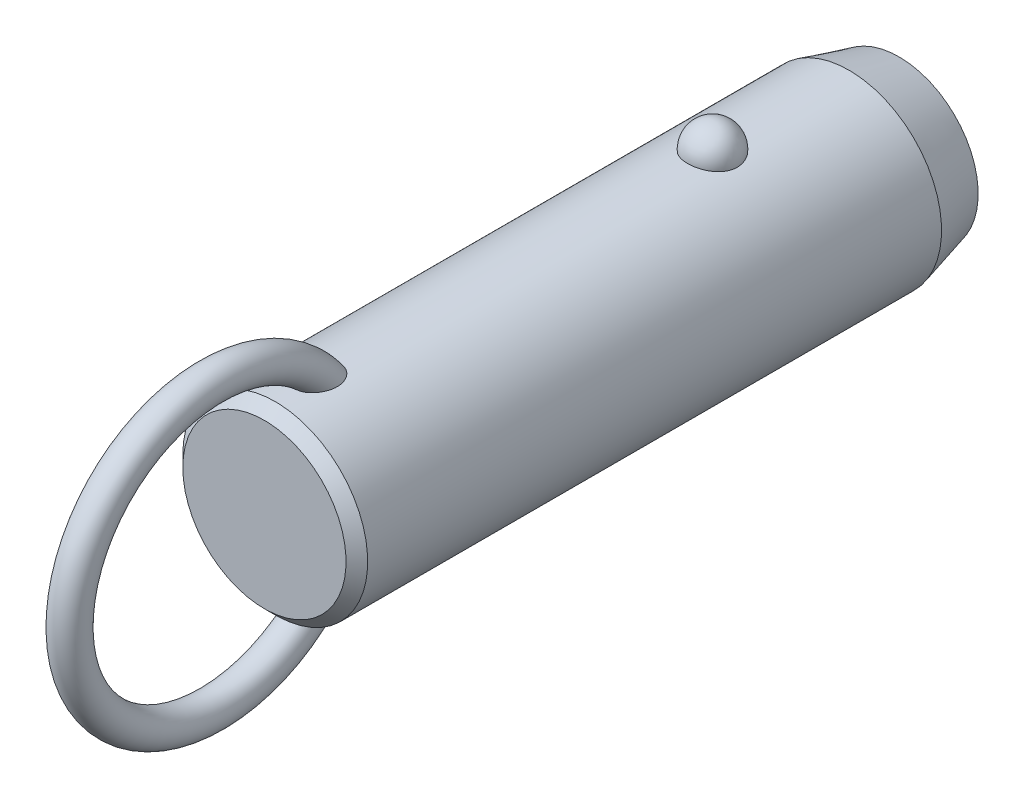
SolidWorks part; units mm, degrees
ref_plane "Front Plane" through (0, 0, 0) normal (0, 0, 1) x (1, 0, 0)
ref_plane "Top Plane" through (0, 0, 0) normal (0, 1, 0) x (1, 0, 0)
ref_plane "Right Plane" through (0, 0, 0) normal (1, 0, 0) x (0, 0, -1)
sketch "Sketch2" plane through (0, 0, 0) normal (0, 0, 1) x (1, 0, 0)
  circle A0 centre (0, 0) radius 11.1
  point P3 (0, 11.1)
  dimension "D1" = 22.2
extrude "Boss-Extrude1" add sketch "Sketch2" along normal blind 38.1
sketch "Sketch3" plane through (0, 0, 0) normal (0, 0, -1) x (-1, 0, 0)
  circle A0 centre (0, 0) radius 11.1
  dimension "D1" = 22.2
extrude "Boss-Extrude2" add sketch "Sketch3" along normal blind 25.4
chamfer "Chamfer1" distance 6 angle 15 1 edges at (-11.1, 0, -25.4)
sketch "Sketch12" plane through (0, 0, 0) normal (1, 0, 0) x (0, 0, -1)
  line L0 (-38.1, 11.1) -> (-38.1, -11.1) construction
  point P0 (-38.1, 0)
sketch "Sketch13" plane through (0, 0, 0) normal (1, 0, 0) x (0, 0, -1)
  circle A0 centre (-57.15, 0) radius 19.05
  point P2 (-38.1, 0)
  dimension "D1" = 38.1
sketch "Sketch14" plane through (0, 0, 0) normal (0, 1, 0) x (1, 0, 0)
  circle A0 centre (0, -40.1) radius 2
  point P2 (0, -38.1)
  dimension "D1" = 4
sweep "Sweep1" add profiles "Sketch14" path "Sketch13"
sketch "Sketch15" plane through (0, 0, 38.1) normal (0, 0, 1) x (1, 0, 0)
  circle A0 centre (0, 0) radius 11.1
  dimension "D1" = 22.2
extrude "Boss-Extrude3" add sketch "Sketch15" along normal blind 12.7
chamfer "Chamfer2" distance 1.3 angle 45 1 edges at (11.1, 0, 50.8)
sketch "Sketch18" plane through (0, 0, 0) normal (1, 0, 0) x (0, 0, -1)
  line L0 (19.4, 11.1) -> (-41.668, 11.1) construction
  line L1 (3, 14.1) -> (3, 8.1)
  line L2 (-41.668, -11.1) -> (19.4, -11.1) construction
  arc A0 (3, 14.1) -> (3, 8.1) centre (3, 11.1) ccw
  point P4 (0, 11.1)
  dimension "D1" = 25.2
revolve "Revolve1" add sketch "Sketch18" angle 360 about L1
